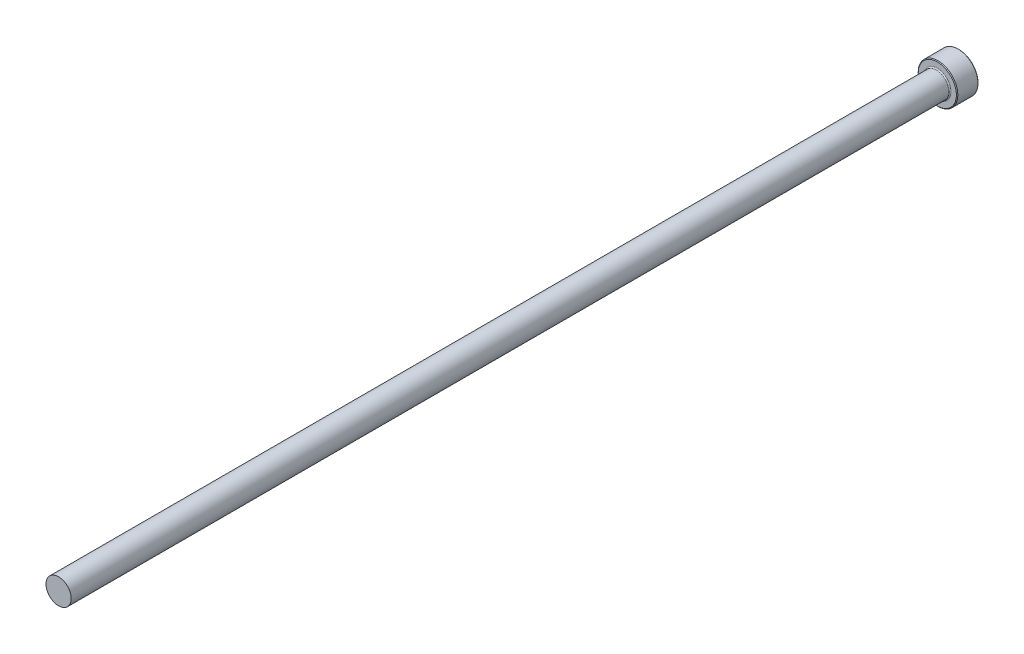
SolidWorks part; units mm, degrees
ref_plane "Front Plane" through (0, 0, 0) normal (0, 0, 1) x (1, 0, 0)
ref_plane "Top Plane" through (0, 0, 0) normal (0, 1, 0) x (1, 0, 0)
ref_plane "Right Plane" through (0, 0, 0) normal (1, 0, 0) x (0, 0, -1)
sketch "Sketch1" plane through (0, 0, 0) normal (1, 0, 0) x (0, 0, -1)
  line L0 (0, 0) -> (0, 5.5)
  line L1 (0, 6.05) -> (0, -6.05) construction
  line L2 (0, 5.5) -> (-6, 5.5)
  line L3 (-6, 5.5) -> (-6, 3.8)
  line L4 (-6.3, 3.5) -> (-250, 3.5)
  line L5 (-250, 3.5) -> (-250, 0)
  line L6 (6.05, 0) -> (-6.05, 0) construction
  line L7 (-250, 0) -> (0, 0)
  line L8 (-109.0506, 0) -> (16.9928, 0) construction
  arc A0 (-6, 3.8) -> (-6.3, 3.5) centre (-6.3, 3.8) cw
  dimension "D1" = 0.3
  dimension "D2" = 11
  dimension "D3" = 7
  dimension "D4" = 250
  dimension "D5" = 6
revolve "Revolve1" add sketch "Sketch1" angle 360 about L8
chamfer "Chamfer1" distance 0.2 angle 45 2 edges at (5.5, 0, 0) (5.5, 0, 6)
